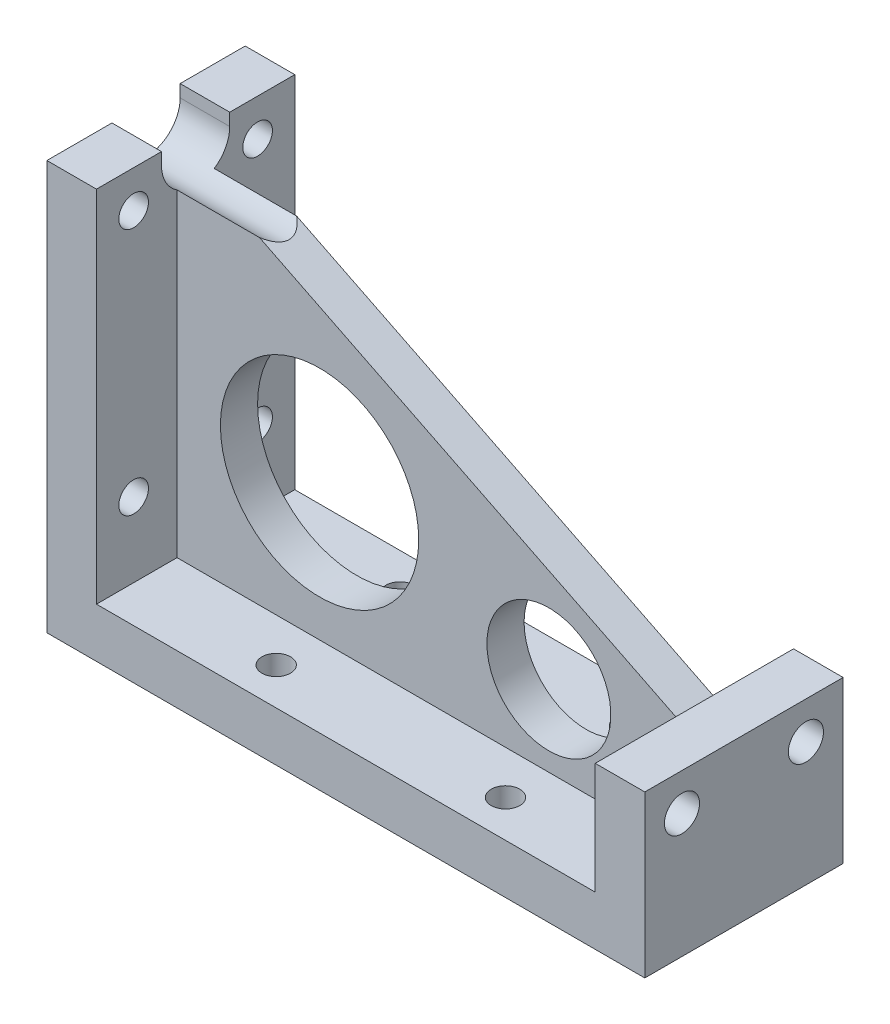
SolidWorks part; units mm, degrees
ref_plane "Front Plane" through (0, 0, 0) normal (0, 0, 1) x (1, 0, 0)
ref_plane "Top Plane" through (0, 0, 0) normal (0, 1, 0) x (1, 0, 0)
ref_plane "Right Plane" through (0, 0, 0) normal (1, 0, 0) x (0, 0, -1)
sketch "Sketch1" plane through (0, 0, 0) normal (0, 0, 1) x (1, 0, 0)
  line L0 (0, 52.3875) -> (0, 0)
  line L1 (0, 0) -> (53.975, 0)
  line L2 (6.35, 52.3875) -> (6.35, 6.35)
  line L3 (6.35, 6.35) -> (53.975, 6.35)
  line L4 (0, 52.3875) -> (6.35, 52.3875)
  line L5 (76.581, 20.6375) -> (76.581, 0)
  line L6 (76.581, 20.6375) -> (70.231, 20.6375)
  line L7 (70.231, 20.6375) -> (70.231, 6.35)
  line L9 (6.35, 6.35) -> (76.581, 6.35) construction
  line L14 (53.975, 0) -> (76.581, 0)
  line L16 (0, 0) -> (76.581, 0) construction
  line L17 (53.975, 6.35) -> (70.231, 6.35)
  dimension "D1" = 6.35
  dimension "D2" = 52.3875
  dimension "D3" = 76.581
  dimension "D4" = 6.35
  dimension "D5" = 20.6375
extrude "Boss-Extrude1" add sketch "Sketch1" along normal mid plane 25.4
sketch "Sketch3" plane through (0, 0, 0) normal (0, 0, 1) x (1, 0, 0)
  line L0 (70.231, 6.35) -> (6.35, 6.35) construction
  line L1 (53.975, 6.35) -> (6.35, 6.35)
  line L2 (6.35, 6.35) -> (6.35, 52.3875)
  line L3 (0, 52.3875) -> (0, 0) construction
  line L4 (0, 0) -> (76.581, 0) construction
  line L5 (70.231, 20.6375) -> (70.231, 6.35) construction
  line L6 (70.231, 6.35) -> (70.231, 20.6375)
  line L7 (70.231, 20.6375) -> (6.35, 52.3875)
  line L14 (53.975, 6.35) -> (70.231, 6.35)
  circle A0 centre (24.6062, 23.8125) radius 12.7
  circle A1 centre (53.975, 16.6688) radius 7.9375
  dimension "D1" = 24.6062
  dimension "D6" = 63.572
  dimension "D7" = 25.4
  dimension "D8" = 15.875
  dimension "D2" = 53.975
  dimension "D3" = 70.231
  dimension "D4" = 23.8125
  dimension "D5" = 16.6687
extrude "Boss-Extrude2" add sketch "Sketch3" along normal mid plane 4.7625
hole_wizard "#6 Clearance Hole1" positions "Sketch5" profile "Sketch4" hole size "#6" standard "ANSI Inch"
sketch "Sketch5" plane through (6.35, 0, 0) normal (1, 0, 0) x (0, 0, -1)
  point P1 (-7.9375, 47.625)
  point P5 (7.9375, 47.625)
  point P8 (7.9375, 15.875)
  point P11 (-7.9375, 15.875)
  dimension "D1" = 7.9375
  dimension "D2" = 7.9375
  dimension "D3" = 15.875
  dimension "D4" = 31.75
sketch "Sketch4" plane through (6.35, 47.625, 7.9375) normal (0, 1, 0) x (0, 0, -1)
  line L0 (0, 0) -> (0, 10.6658)
  line L1 (0, 10.6658) -> (1.8986, 9.525)
  line L2 (1.8986, 9.525) -> (1.8986, 0)
  line L5 (1.8986, 0) -> (0, 0)
  line L10 (0, 10.6658) -> (-1.8987, 9.525) construction
  line L11 (0, -6.35) -> (0, 107.95) construction
  dimension "Hole Dia." = 3.7973
  dimension "Hole Depth" = 9.525
  dimension "Drill Angle" = 118
hole_wizard "#8 Clearance Hole1" positions "Sketch7" profile "Sketch6" hole size "#8" standard "ANSI Inch"
sketch "Sketch7" plane through (76.581, 0, 0) normal (1, 0, 0) x (0, 0, -1)
  point P0 (7.9375, 15.875)
  point P3 (-7.9375, 15.875)
sketch "Sketch6" plane through (76.581, 15.875, -7.9375) normal (0, 1, 0) x (0, 0, -1)
  line L0 (0, 0) -> (0, 6.35)
  line L1 (0, 6.35) -> (2.2479, 6.35)
  line L2 (2.2479, 6.35) -> (2.2479, 0)
  line L5 (2.2479, 0) -> (0, 0)
  line L11 (0, -6.35) -> (0, 107.95) construction
  dimension "Thru Hole Dia." = 4.4958
  dimension "Thru Hole Depth" = 6.35
sketch "Sketch8" plane through (0, 0, 0) normal (-1, 0, 0) x (0, 0, 1)
  line L0 (12.7, 52.3875) -> (-12.7, 52.3875) construction
  line L1 (-4.3688, 52.3875) -> (4.3688, 52.3875)
  line L2 (-4.3688, 52.3875) -> (-4.3688, 50.8)
  line L3 (0, 50.8) -> (0, 0) construction
  line L4 (4.3688, 52.3875) -> (4.3688, 50.8)
  arc A0 (4.3688, 50.8) -> (-4.3688, 50.8) centre (0, 50.8) cw
  dimension "D1" = 4.3688
  dimension "D2" = 1.5875
extrude "VentSlot" cut sketch "Sketch8" against normal through all
hole_wizard "#6 Clearance Hole4" positions "Sketch12" profile "Sketch11" hole size "#6" standard "ANSI Inch"
sketch "Sketch12" plane through (0, 6.35, 0) normal (0, 1, 0) x (1, 0, 0)
  point P0 (6.8843, -405.3515)
  point P1 (53.975, -7.9375)
  point P4 (24.6063, -7.9375)
  point P6 (24.6063, 7.9375)
  point P8 (53.975, 7.9375)
  dimension "D1" = 24.6062
  dimension "D2" = 53.975
  dimension "D3" = 7.9375
  dimension "D4" = 7.9375
sketch "Sketch11" plane through (6.8843, 6.35, 405.3515) normal (1, 0, 0) x (0, 0, 1)
  line L0 (0, 0) -> (0, 6.35)
  line L1 (0, 6.35) -> (1.8288, 6.35)
  line L2 (1.8288, 6.35) -> (1.8288, 0)
  line L5 (1.8288, 0) -> (0, 0)
  line L11 (0, -6.35) -> (0, 107.95) construction
  dimension "Thru Hole Dia." = 3.6576
  dimension "Thru Hole Depth" = 6.35
equation "\"Buoyancy\"= \"SW-Volume\" * ( \"SW-Density\" - .037062 )"
